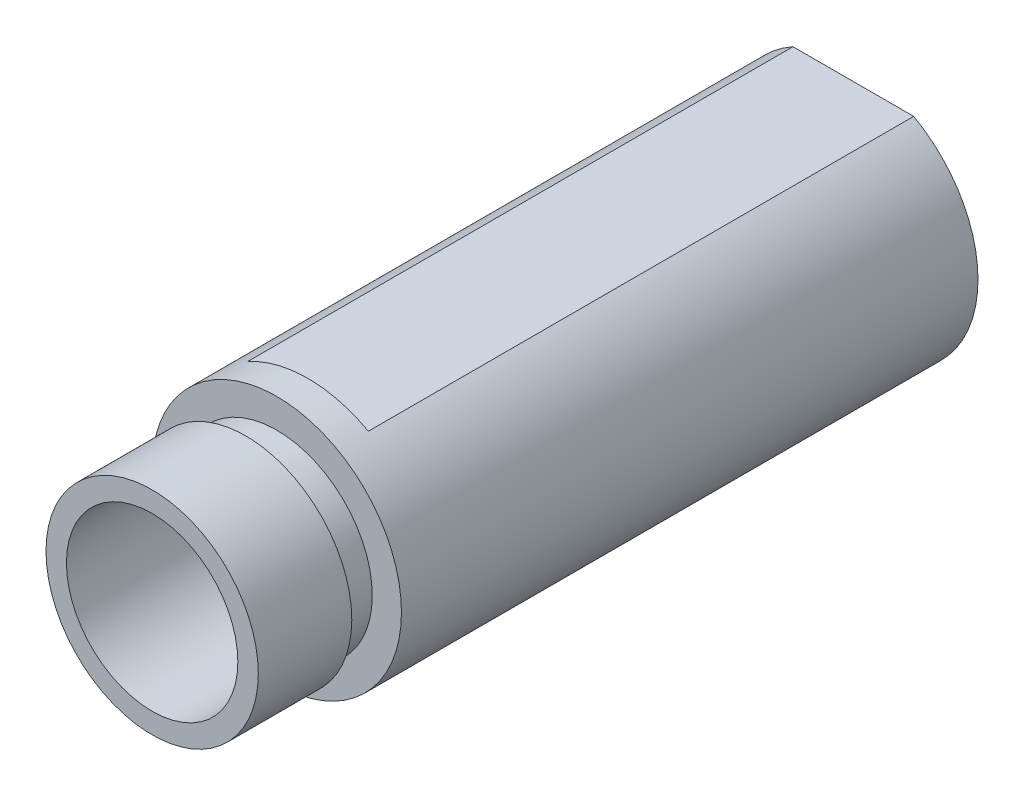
SolidWorks part; units mm, degrees
ref_plane "Face" through (0, 0, 0) normal (0, 0, 1) x (1, 0, 0)
ref_plane "Dessus" through (0, 0, 0) normal (0, 1, 0) x (1, 0, 0)
ref_plane "Droite" through (0, 0, 0) normal (1, 0, 0) x (0, 0, -1)
sketch "Esquisse1" plane through (0, 0, 0) normal (0, 0, 1) x (1, 0, 0)
  circle A0 centre (0, 0) radius 10
  dimension "D1" = 20
extrude "Extrusion1" add sketch "Esquisse1" along normal blind 45
sketch "Esquisse2" plane through (0, 0, 45) normal (0, 0, 1) x (1, 0, 0)
  circle A0 centre (0, 0) radius 5.5
  dimension "D1" = 11
extrude "Enlèv. mat.-Extru.1" cut sketch "Esquisse2" against normal blind 42
sketch "Esquisse3" plane through (0, 0, 3) normal (0, 0, 1) x (1, 0, 0)
  circle A0 centre (0, 0) radius 4
  dimension "D1" = 8
extrude "Enlèv. mat.-Extru.2" cut sketch "Esquisse3" against normal through all
sketch "Esquisse4" plane through (0, 0, 45) normal (0, 0, 1) x (1, 0, 0)
  circle A0 centre (0, 0) radius 8
  dimension "D1" = 16
extrude "Enlèv. mat.-Extru.3" cut sketch "Esquisse4" against normal through all flip side to cut
sketch "Esquisse5" plane through (0, 0, 45) normal (0, 0, 1) x (1, 0, 0)
  circle A0 centre (0, 0) radius 6.8119
  dimension "D1" = 13.6237
extrude "Enlèv. mat.-Extru.4" cut sketch "Esquisse5" against normal blind 6 flip side to cut
sketch "Esquisse6" plane through (0, 0, 39) normal (0, 0, 1) x (1, 0, 0)
  circle A0 centre (0, 0) radius 6.125
  dimension "D1" = 12.25
extrude "Enlèv. mat.-Extru.5" cut sketch "Esquisse6" against normal blind 2 flip side to cut
sketch "Esquisse7" plane through (0, 0, 0) normal (0, 0, -1) x (-1, 0, 0)
  line L1 (-16.8724, 7) -> (12.0579, 7)
  line L2 (-16.8724, 7) -> (-16.8724, 15.8683)
  line L3 (-16.8724, 15.8683) -> (12.0579, 15.8683)
  line L4 (12.0579, 7) -> (12.0579, 15.8683)
  dimension "D1" = 7
extrude "Enlèv. mat.-Extru.6" cut sketch "Esquisse7" against normal blind 35
sketch "Esquisse8" plane through (0, 7, 0) normal (0, 1, 0) x (-1, 0, 0)
  line L0 (2.3486, 0.6837) -> (2.3486, 47.8653) construction
sketch "Esquisse9" plane through (0, 7, 0) normal (0, 1, 0) x (-1, 0, 0)
  text T0 "ISP 2006/07" font "Comic Sans MS" height in points 15
